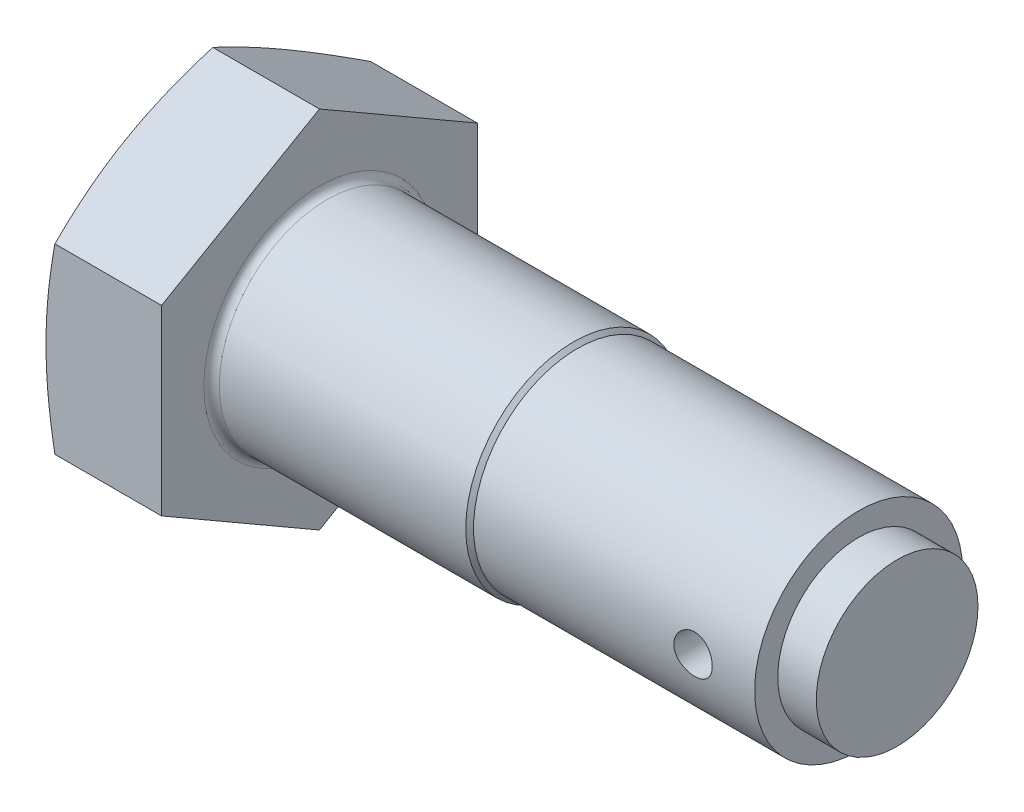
SolidWorks part; units mm, degrees
ref_plane "Front" through (0, 0, 0) normal (0, 0, 1) x (1, 0, 0)
ref_plane "Top" through (0, 0, 0) normal (0, 1, 0) x (1, 0, 0)
ref_plane "Right" through (0, 0, 0) normal (1, 0, 0) x (0, 0, -1)
sketch "Sketch1" plane through (0, 0, 0) normal (1, 0, 0) x (0, 0, -1)
  line L1 (0, -23.6714) -> (20.5, -11.8357)
  line L2 (20.5, -11.8357) -> (20.5, 11.8357)
  line L3 (20.5, 11.8357) -> (0, 23.6714)
  line L4 (0, 23.6714) -> (-20.5, 11.8357)
  line L5 (-20.5, 11.8357) -> (-20.5, -11.8357)
  line L6 (-20.5, -11.8357) -> (0, -23.6714)
  circle A0 centre (0, 0) radius 20.5 construction
  dimension "s" = 41
extrude "BaseHead" add sketch "Sketch1" along normal blind 15
sketch "Sketch2" plane through (15, 0, 0) normal (1, 0, 0) x (0, 0, -1)
  circle A0 centre (0, 0) radius 14
  dimension "ds" = 28
extrude "Basebody1" add sketch "Sketch2" along normal blind 33
sketch "Sketch4" plane through (48, 0, 0) normal (1, 0, 0) x (0, 0, -1)
  circle A0 centre (0, 0) radius 13.5
  dimension "d" = 27
extrude "Basebody2" add sketch "Sketch4" along normal offset from surface (42 mm away) 75
sketch "Sketch5" plane through (90, 0, 0) normal (1, 0, 0) x (0, 0, -1)
  circle A0 centre (0, 0) radius 10.5
  dimension "dp" = 21
extrude "Cut-Extrude1" cut sketch "Sketch5" against normal blind 5 flip side to cut
sketch "Sketch6" plane through (0, 0, 0) normal (0, 0, 1) x (1, 0, 0)
  line L0 (0, 23.6714) -> (1.1543, 23.6714)
  line L1 (1.1543, 23.6714) -> (0, 20.5)
  line L3 (0, 20.5) -> (0, 23.6714)
  line L4 (-1.5773, 0) -> (3.1205, 0) construction
  line L6 (15, 23.6714) -> (0, 23.6714) construction
  dimension "D1" = 20
  dimension "D2" = 41
revolve "HeadChamfer" cut sketch "Sketch6" angle 360 about L4
fillet "HeadFillet" radius 1 1 edges at (15, 0, 14)
chamfer "Chamfer1" distance 0.5 angle 45 1 edges at (48, 0, -13.5)
sketch "Sketch7" plane through (0, 0, 0) normal (0, 0, 1) x (1, 0, 0)
  line L1 (15, 23.6714) -> (15, 11.8357) construction
  line L4 (85, 0) -> (48.5, 0) construction
  circle A0 centre (77, 0) radius 2.5
  dimension "d1" = 5
  dimension "lh" = 62
extrude "Hole" cut sketch "Sketch7" against normal through all and the other way through all
equation "\"D1@Chamfer1\" =  ( \"ds@Sketch2\" - \"d@Sketch4\" )  / 2"
equation "\"D2@Sketch6\" = \"s@Sketch1\""
